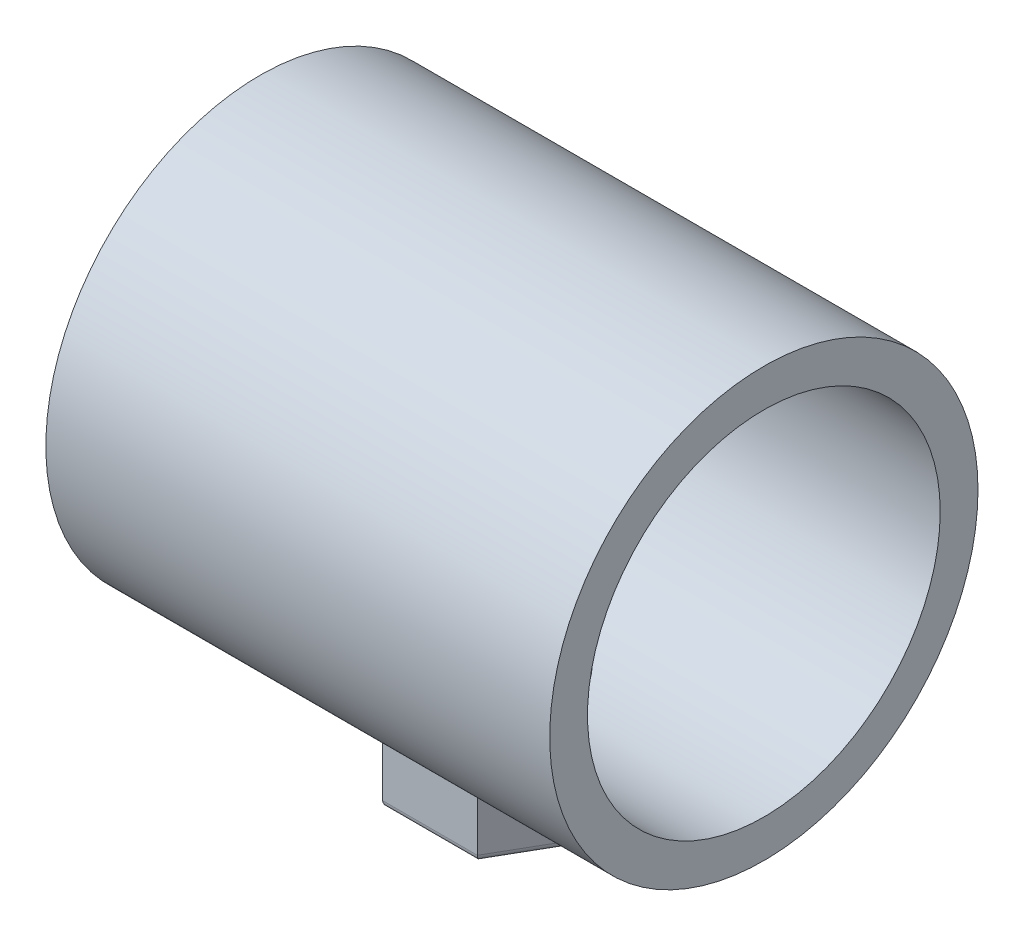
SolidWorks part; units mm, degrees
ref_plane "Plan de face" through (0, 0, 0) normal (0, 0, 1) x (1, 0, 0)
ref_plane "Plan de dessus" through (0, 0, 0) normal (0, 1, 0) x (1, 0, 0)
ref_plane "Plan de droite" through (0, 0, 0) normal (1, 0, 0) x (0, 0, -1)
sketch "Esquisse1" plane through (0, 0, 0) normal (1, 0, 0) x (0, 0, -1)
  circle A0 centre (0, 0) radius 17
  circle A1 centre (0, 0) radius 14
  dimension "D1" = 28
  dimension "D2" = 34
extrude "Extrusion1" add sketch "Esquisse1" along normal blind 40
sketch "Esquisse2" plane through (0, 0, 0) normal (0, 1, 0) x (1, 0, 0)
  line L0 (0, 17) -> (0, -17) construction
  circle A0 centre (20, 0) radius 4.5
  dimension "D1" = 9
  dimension "D2" = 20
extrude "Enlèv. mat.-Extru.1" cut sketch "Esquisse2" against normal up to next
inserted part "écrou M8"
move or copy body "Corps-Déplacer/Copier2" placed by mates yes
other "<écrou M8>-<Congé1>"
